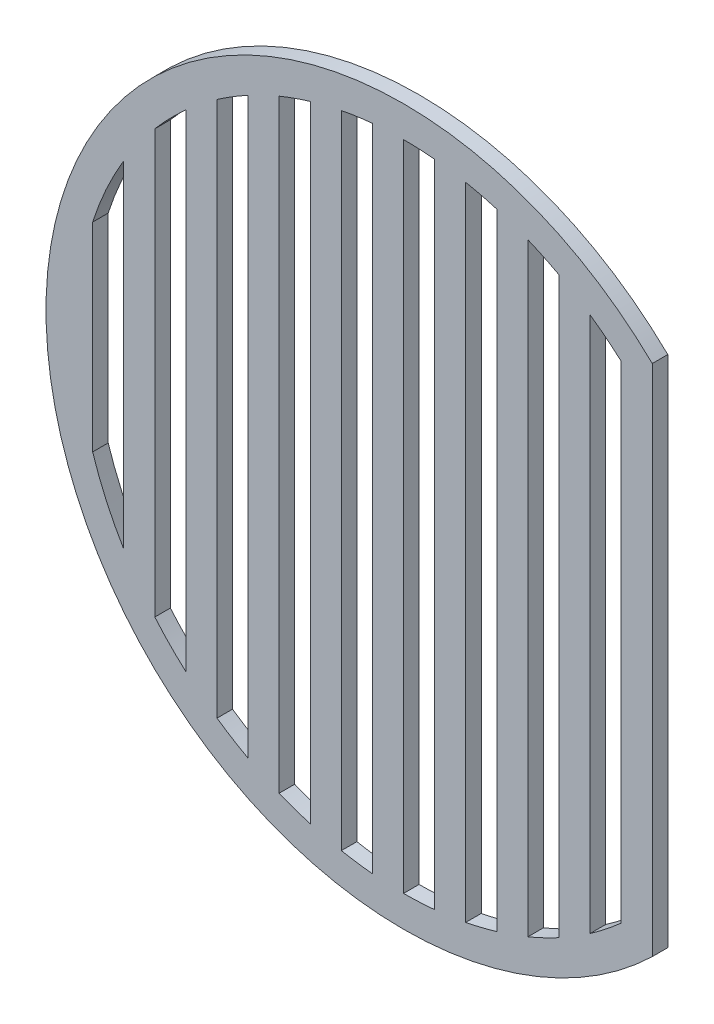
SolidWorks part; units mm, degrees
ref_plane "Front Plane" through (0, 0, 0) normal (0, 0, 1) x (1, 0, 0)
ref_plane "Top Plane" through (0, 0, 0) normal (0, 1, 0) x (1, 0, 0)
ref_plane "Right Plane" through (0, 0, 0) normal (1, 0, 0) x (0, 0, -1)
sketch "Sketch1" plane through (0, 0, 0) normal (0, 0, 1) x (1, 0, 0)
  line L0 (50.8, 52.4596) -> (50.8, -52.4596)
  arc A0 (50.8, 52.4596) -> (50.8, -52.4596) centre (0, 0) ccw
  dimension "D1" = 73.025
  dimension "D2" = 50.8
extrude "Boss-Extrude1" add sketch "Sketch1" along normal blind 3.175
sketch "Sketch2" plane through (0, 0, 3.175) normal (0, 0, 1) x (1, 0, 0)
  line L0 (38.1, 54.717) -> (38.1, -54.717)
  line L1 (44.45, 49.6966) -> (44.45, -49.6966)
  line L2 (50.8, -52.4596) -> (50.8, 52.4596) construction
  arc A1 (38.1, -54.717) -> (44.45, -49.6966) centre (0, 0) ccw
  arc A2 (46.3826, 47.8979) -> (46.3826, -47.8979) centre (0, 0) ccw
  arc A3 (44.45, 49.6966) -> (38.1, 54.717) centre (0, 0) ccw
  dimension "D2" = 6.35
  dimension "D3" = 6.35
  dimension "D1" = 6.35
extrude "Cut-Extrude1" cut sketch "Sketch2" against normal through all
pattern_linear "LPattern1" count 9 spacing 12.7 of "Cut-Extrude1"
